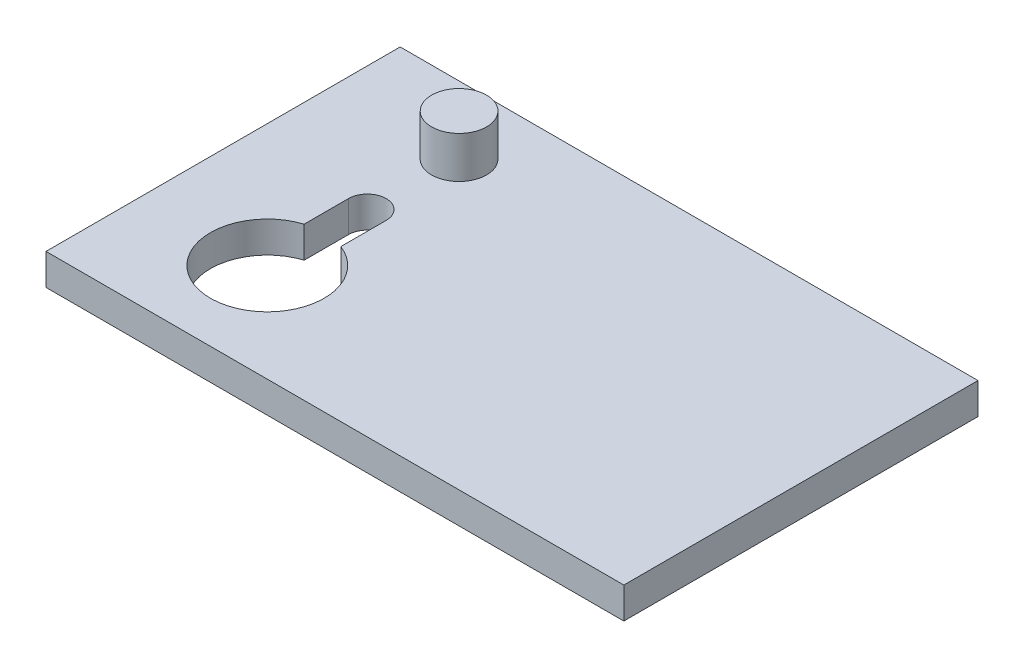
SolidWorks part; units mm, degrees
ref_plane "Front Plane" through (0, 0, 0) normal (0, 0, 1) x (1, 0, 0)
ref_plane "Top Plane" through (0, 0, 0) normal (0, 1, 0) x (1, 0, 0)
ref_plane "Right Plane" through (0, 0, 0) normal (1, 0, 0) x (0, 0, -1)
sketch "Sketch1" plane through (0, 0, 0) normal (0, 1, 0) x (1, 0, 0)
  line L0 (-70.4702, -43.1914) -> (70.4702, 43.1914) construction
  line L1 (-70.4702, 43.1914) -> (70.4702, 43.1914)
  line L2 (-70.4702, 43.1914) -> (-70.4702, -43.1914)
  line L3 (-70.4702, -43.1914) -> (70.4702, -43.1914)
  line L4 (70.4702, 43.1914) -> (70.4702, -43.1914)
extrude "Extrude1" add sketch "Sketch1" along normal blind 7.62
sketch "Sketch2" plane through (0, 7.62, 0) normal (0, 1, 0) x (-1, 0, 0)
  line L0 (35.5336, -4.8577) -> (35.5336, 6.2156)
  line L1 (44.7435, -4.8577) -> (44.7435, 5.952)
  arc A0 (44.7435, 5.952) -> (35.5336, 6.2156) centre (40.5131, 19.1668) ccw
  arc A1 (35.5336, -4.8577) -> (44.7435, -4.8577) centre (40.1386, -4.8577) ccw
extrude "Cut-Extrude1" cut sketch "Sketch2" against normal through all
sketch "Sketch3" plane through (0, 7.62, 0) normal (0, 1, 0) x (-1, 0, 0)
  circle A0 centre (39.5901, -26.6841) radius 6.7095
extrude "Extrude2" add sketch "Sketch3" along normal blind 10.16
